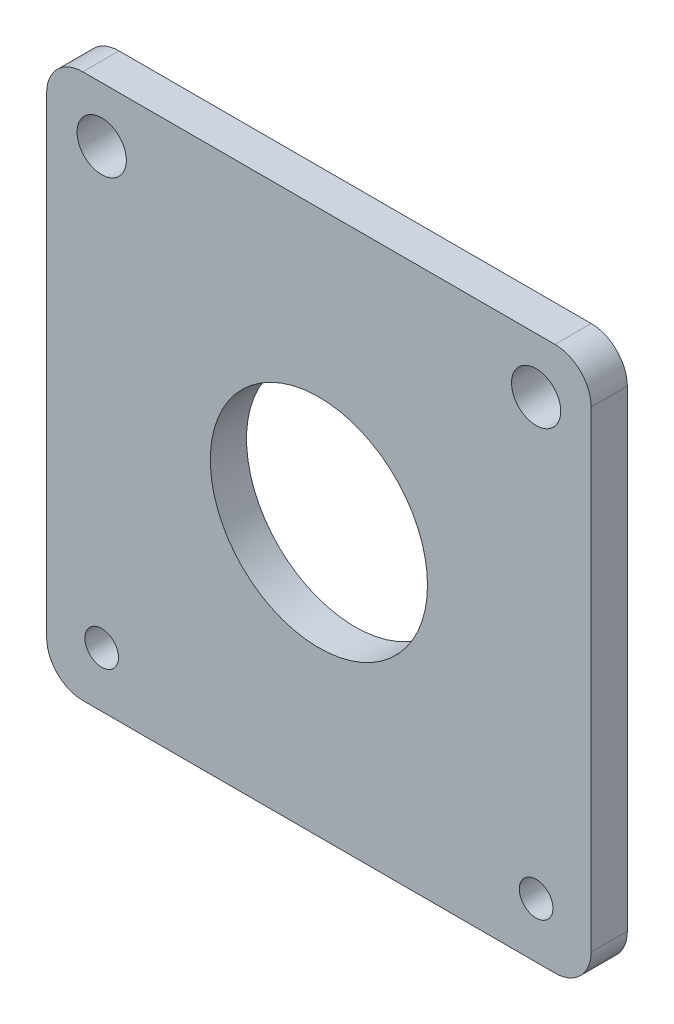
SolidWorks part; units mm, degrees
ref_plane "Plane1" through (0, 0, 0) normal (0, 0, 1) x (1, 0, 0)
ref_plane "Plane2" through (0, 0, 0) normal (0, 1, 0) x (1, 0, 0)
ref_plane "Plane3" through (0, 0, 0) normal (1, 0, 0) x (0, 0, -1)
sketch "Sketch1" plane through (0, 0, 0) normal (0, 0, 1) x (1, 0, 0)
  line L0 (0, 0) -> (0, 23.876) construction
  line L1 (0, 0) -> (23.876, 0) construction
  line L2 (-23.876, 23.876) -> (23.876, 23.876)
  line L3 (23.876, 23.876) -> (23.876, -23.876)
  line L4 (-23.876, 23.876) -> (-23.876, -23.876)
  line L5 (-23.876, -23.876) -> (23.876, -23.876)
  circle A0 centre (0, 0) radius 9.525
  circle A1 centre (19.05, 19.05) radius 2.159
  circle A2 centre (-19.05, 19.05) radius 2.159
  circle A3 centre (19.05, -19.05) radius 1.4732
  circle A4 centre (-19.05, -19.05) radius 1.4732
  point P10 (-23.876, 0)
  dimension "D1" = 23.876
  dimension "D2" = 23.876
  dimension "D3" = 19.05
  dimension "D4" = 4.318
  dimension "D5" = 19.05
  dimension "D6" = 19.05
  dimension "D7" = 2.9464
  dimension "D8" = 19.05
  dimension "D9" = 19.05
extrude "Extrude1" add sketch "Sketch1" along normal blind 3.175
fillet "Fillet1" radius 3.175 4 edges at (23.876, 23.876, 1.5875) (23.876, -23.876, 1.5875) (-23.876, -23.876, 1.5875) (-23.876, 23.876, 1.5875)
